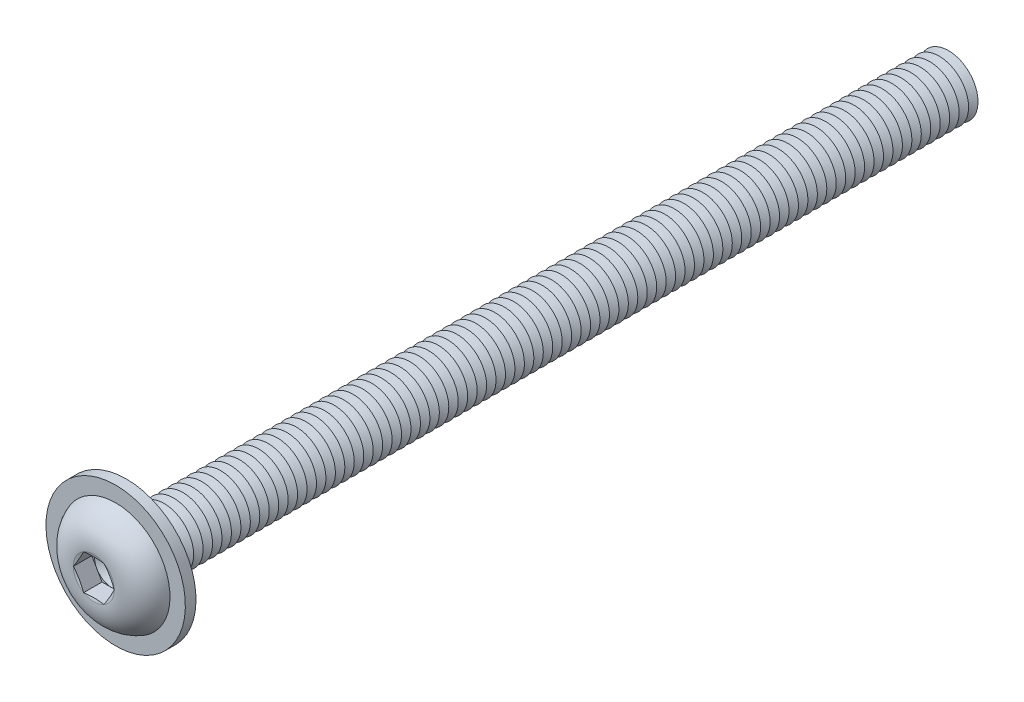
SolidWorks part; units mm, degrees
ref_plane "Front Plane" through (0, 0, 0) normal (0, 0, 1) x (1, 0, 0)
ref_plane "Top Plane" through (0, 0, 0) normal (0, 1, 0) x (1, 0, 0)
ref_plane "Right Plane" through (0, 0, 0) normal (1, 0, 0) x (0, 0, -1)
sketch "Sketch1" plane through (0, 0, 0) normal (1, 0, 0) x (0, 0, -1)
  line L0 (0, 2.5) -> (0, 4.75)
  line L3 (0, 2.5) -> (70, 2.5)
  line L4 (70, 2.5) -> (70, 0)
  line L5 (70, 0) -> (-2.75, 0) construction
  line L6 (-2.75, 0) -> (70, 0)
  line L7 (-2.75, 1.732) -> (-2.75, 0.866) construction
  line L8 (-2.75, 0.866) -> (-2.75, 0)
  line L9 (-2.75, 1.732) -> (-2.5179, 0.866)
  line L10 (-2.5179, 0.866) -> (-2.75, 0.866)
  line L11 (70, 0) -> (22.7481, 0) construction
  line L12 (0, 4.75) -> (-2.75, 4.75) construction
  arc A1 (0, 4.75) -> (-2.75, 1.732) centre (0, 1.9881) ccw
  point P8 (70, 1.25)
  dimension "D1" = 9.5
  dimension "D2" = 5
  dimension "D3" = 2.75
  dimension "D4" = 3.4641
  dimension "D5" = 70
  dimension "D6" = 15
revolve "Revolve1" add sketch "Sketch1" angle 360 about L5
fillet "Fillet1" radius 0.4 1 edges at (0, 2.5, 0)
sketch "Sketch2" plane through (0, 0, 0) normal (1, 0, 0) x (0, 0, -1)
  line L0 (69.6, 2.5) -> (70.4, 2.5)
  line L1 (70, 2.5) -> (0.4, 2.5) construction
  line L2 (70.4, 2.5) -> (70, 1.8072)
  line L3 (70, -2.5) -> (70, 2.5) construction
  line L4 (70, 1.8072) -> (69.6, 2.5)
  dimension "D1" = 0.8
revolve "Cut-Revolve1" cut sketch "Sketch2" angle 360 about axis through (0, 0, -70) along (0, 0, -1)
pattern_linear "LPattern1" count 87 spacing 0.8 along (0, 0, 1) of "Cut-Revolve1"
sketch "Sketch3" plane through (0, 0, 2.75) normal (0, 0, 1) x (1, 0, 0)
  line L7 (0.866, 1.5) -> (-0.866, 1.5)
  line L8 (-0.866, 1.5) -> (-1.7321, 0)
  line L9 (-1.7321, 0) -> (-0.866, -1.5)
  line L10 (-0.866, -1.5) -> (0.866, -1.5)
  line L11 (0.866, -1.5) -> (1.732, 0)
  line L12 (1.732, 0) -> (0.866, 1.5)
  circle A0 centre (0, 0) radius 1.5 construction
  circle A3 centre (0, 0) radius 1.7321 construction
extrude "Cut-Extrude1" cut sketch "Sketch3" against normal blind 1.56
sketch "Sketch4" plane through (0, 0, 1.19) normal (0, 0, 1) x (1, 0, 0)
  line L1 (0.866, 1.5) -> (-0.866, 1.5) construction
  circle A0 centre (0, 0) radius 1.5
extrude "Cut-Extrude2" cut sketch "Sketch4" against normal through all draft 60
sketch "Sketch5" plane through (0, 0, 0) normal (0, 0, -1) x (-1, 0, 0)
  circle A0 centre (0, 0) radius 5.9
  circle A1 centre (0, 0) radius 2.9
  circle A2 centre (0, 0) radius 2.9 construction
  dimension "D1" = 11.8
extrude "Boss-Extrude1" add sketch "Sketch5" against normal blind 0.9
